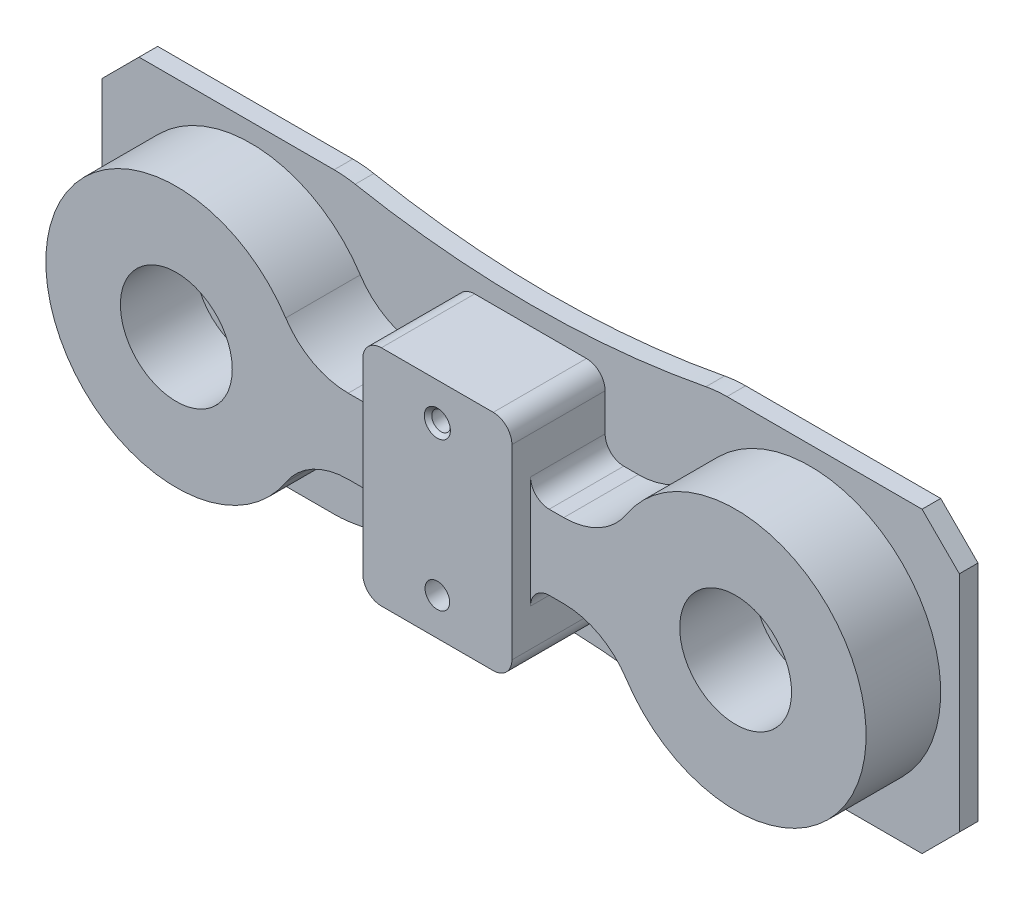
SolidWorks part; units mm, degrees
ref_plane "Ebene vorne" through (0, 0, 0) normal (0, 0, 1) x (1, 0, 0)
ref_plane "Ebene oben" through (0, 0, 0) normal (0, 1, 0) x (1, 0, 0)
ref_plane "Ebene rechts" through (0, 0, 0) normal (1, 0, 0) x (0, 0, -1)
sketch "Skizze2" plane through (0, 0, 0) normal (0, 0, 1) x (1, 0, 0)
  line L0 (-115, 30) -> (-105, 40)
  line L1 (-105, -40) -> (105, -40)
  line L2 (-115, -30) -> (-115, 30)
  line L3 (-105, 40) -> (105, 40)
  line L4 (115, -30) -> (115, 30)
  line L5 (-115, -40) -> (115, 40) construction
  line L6 (-115, 40) -> (115, -40) construction
  line L7 (105, 40) -> (115, 30)
  line L8 (105, -40) -> (115, -30)
  line L9 (-115, -30) -> (-105, -40)
  point P0 (0, 0)
  dimension "D1" = 230
  dimension "D2" = 80
extrude "Aufsatz-Linear austragen1" add sketch "Skizze2" along normal blind 5
sketch "Skizze3" plane through (0, 0, 5) normal (0, 0, 1) x (1, 0, 0)
  line L0 (-127.4518, 0) -> (127.2143, 0) construction
  line L1 (0, -44.8992) -> (0, 43.2362) construction
  line L2 (-28.9023, 10) -> (28.9023, 10)
  line L3 (-28.9023, -10) -> (28.9023, -10)
  arc A0 (-45.6651, -19.0909) -> (-45.6651, 19.0909) centre (-75, 0) cw
  arc A1 (-45.6651, 19.0909) -> (-28.9023, 10) centre (-28.9023, 30) ccw
  arc A2 (-45.6651, -19.0909) -> (-28.9023, -10) centre (-28.9023, -30) cw
  arc A3 (45.6651, -19.0909) -> (28.9023, -10) centre (28.9023, -30) ccw
  arc A4 (45.6651, 19.0909) -> (28.9023, 10) centre (28.9023, 30) cw
  arc A5 (45.6651, -19.0909) -> (45.6651, 19.0909) centre (75, 0) ccw
  point P6 (0, 10)
  point P21 (0, -10)
  dimension "D1" = 35
  dimension "D2" = 20
  dimension "D3" = 20
  dimension "D4" = 150
extrude "Aufsatz-Linear austragen2" add sketch "Skizze3" along normal blind 20
sketch "Skizze4" plane through (0, 0, 25) normal (0, 0, 1) x (1, 0, 0)
  circle A0 centre (-75, 0) radius 15
  circle A1 centre (75, 0) radius 15
  dimension "D1" = 30
extrude "Schnitt-Linear austragen1" cut sketch "Skizze4" against normal up to surface (20 mm away)
sketch "Skizze5" plane through (0, 0, 5) normal (0, 0, 1) x (1, 0, 0)
  line L1 (-20, -30) -> (20, -30)
  line L2 (-20, -30) -> (-20, 30)
  line L3 (-20, 30) -> (20, 30)
  line L4 (20, -30) -> (20, 30)
  line L5 (-20, -30) -> (20, 30) construction
  line L6 (-20, 30) -> (20, -30) construction
  point P0 (0, 0)
  dimension "D1" = 40
  dimension "D2" = 60
extrude "Aufsatz-Linear austragen3" add sketch "Skizze5" along normal offset from surface (25 mm away) 5
fillet "Verrundung1" radius 5 8 edges at (-20, 30, 17.5) (20, 30, 17.5) (-20, -30, 17.5) (20, -30, 17.5) (20, 10, 15) (-20, 10, 15) (-20, -10, 15) (20, -10, 15)
hole_wizard "M6 Gewindebohrung1" positions "Skizze7" profile "Skizze6" tap size "M6" standard "DIN"
sketch "Skizze7" plane through (0, 0, 30) normal (0, 0, 1) x (1, 0, 0)
  point P0 (0, 20)
  dimension "D1" = 20
sketch "Skizze6" plane through (0, 20, 30) normal (1, 0, 0) x (0, -1, 0)
  line L0 (0, 0) -> (0, 26.5022)
  line L1 (0, 26.5022) -> (2.5, 25)
  line L2 (2.5, 25) -> (2.5, 1)
  line L3 (2.5, 1) -> (3.5, 0)
  line L5 (3.5, 0) -> (0, 0)
  line L6 (-2.5, 1) -> (-3.5, 0) construction
  line L10 (0, 26.5022) -> (-2.5, 25) construction
  line L11 (0, -6.35) -> (0, 107.95) construction
  dimension "Bohrerdurchmesser" = 5
  dimension "Bohrungstiefe" = 25
  dimension "Senkdurchmesser (Oben)" = 7
  dimension "Senkwinkel (Oben)" = 90
  dimension "Spitzenwinkel" = 118
hole_wizard "Stirnsenkung für M6 Zylinderschraube mit Innensechskant1" positions "Skizze9" profile "Skizze8" counterbore size "M6" standard "DIN"
sketch "Skizze9" plane through (0, 0, 0) normal (0, 0, -1) x (-1, 0, 0)
  point P0 (0, -20)
  dimension "D1" = 20
sketch "Skizze8" plane through (0, -20, 0) normal (1, 0, 0) x (0, 1, 0)
  line L0 (0, 0) -> (0, 30)
  line L1 (0, 30) -> (3.3, 30)
  line L3 (3.3, 30) -> (3.3, 6.4)
  line L4 (3.3, 6.4) -> (5.5, 6.4)
  line L5 (5.5, 6.4) -> (5.5, 0)
  line L7 (5.5, 0) -> (0, 0)
  line L11 (0, -6.35) -> (0, 107.95) construction
  dimension "Bohrerdurchmesser" = 6.6
  dimension "Bohrungstiefe" = 30
  dimension "Senkdurchmesser2" = 11
  dimension "Senktiefe2" = 6.4
sketch "Skizze10" plane through (0, 0, 5) normal (0, 0, 1) x (1, 0, 0)
  line L0 (-105, -40) -> (105, -40) construction
  line L1 (-49.7494, -40) -> (49.7494, -40)
  line L2 (-49.7494, 40) -> (49.7494, 40)
  line L3 (-129.4968, 0) -> (131.3928, 0) construction
  arc A0 (49.7494, -40) -> (-49.7494, -40) centre (0, -285) ccw
  arc A1 (49.7494, 40) -> (-49.7494, 40) centre (0, 285) cw
  dimension "D1" = 5
  dimension "D2" = 250
extrude "Schnitt-Linear austragen3" cut sketch "Skizze10" against normal through all
fillet "Verrundung2" radius 30 4 edges at (49.7494, 40, 2.5) (-49.7494, 40, 2.5) (-49.7494, -40, 2.5) (49.7494, -40, 2.5)
